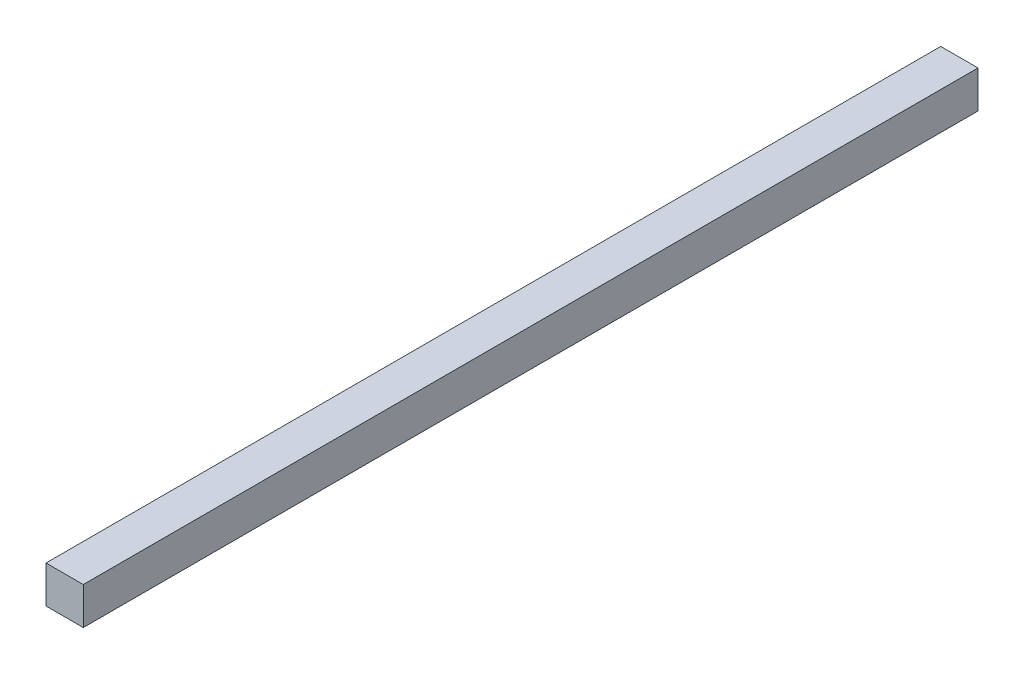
SolidWorks part; units mm, degrees
ref_plane "Front Plane" through (0, 0, 0) normal (0, 0, 1) x (1, 0, 0)
ref_plane "Top Plane" through (0, 0, 0) normal (0, 1, 0) x (1, 0, 0)
ref_plane "Right Plane" through (0, 0, 0) normal (1, 0, 0) x (0, 0, -1)
sketch "Sketch1" plane through (0, 0, 0) normal (0, 0, 1) x (1, 0, 0)
  line L1 (0, 6.35) -> (6.35, 6.35)
  line L2 (0, 6.35) -> (0, 0)
  line L3 (0, 0) -> (6.35, 0)
  line L4 (6.35, 6.35) -> (6.35, 0)
  dimension "D1" = 6.35
  dimension "D2" = 6.35
extrude "Extrude1" add sketch "Sketch1" along normal blind 152.4
